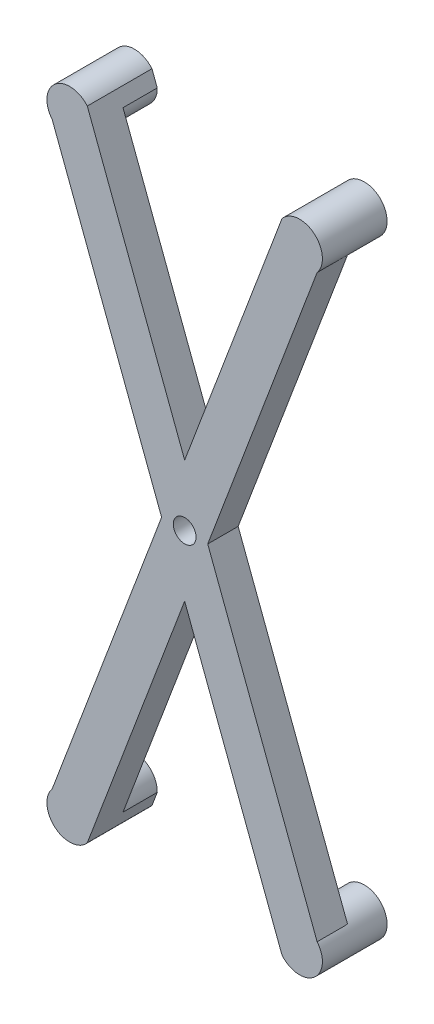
SolidWorks part; units mm, degrees
ref_plane "Plan de face" through (0, 0, 0) normal (0, 0, 1) x (1, 0, 0)
ref_plane "Plan de dessus" through (0, 0, 0) normal (0, 1, 0) x (1, 0, 0)
ref_plane "Plan de droite" through (0, 0, 0) normal (1, 0, 0) x (0, 0, -1)
sketch "Esquisse1" plane through (0, 0, 0) normal (0, 0, 1) x (1, 0, 0)
  line L15 (-60.1246, 38.5473) -> (-29.9246, -41.4527)
  line L16 (-55.5153, 42.3884) -> (-25.3153, -37.6116)
  line L17 (-29.9246, 42.3884) -> (-60.1246, -37.6116)
  line L18 (-25.3153, 38.5473) -> (-55.5153, -41.4527)
  circle A9 centre (-27.6199, -39.5321) radius 1.4
  circle A10 centre (-57.8199, -39.5321) radius 1.4
  circle A11 centre (-57.8199, 40.4679) radius 1.4
  circle A12 centre (-27.6199, 40.4679) radius 1.4
  circle A13 centre (-57.8199, -39.5321) radius 3
  circle A14 centre (-27.6199, -39.5321) radius 3
  circle A15 centre (-27.6199, 40.4679) radius 3
  circle A16 centre (-57.8199, 40.4679) radius 3
  circle A17 centre (-42.7199, 0.4679) radius 1.5
  point P0 (0, 0)
  point P18 (-29.9246, 42.3884)
  point P20 (-25.3153, 38.5473)
  point P21 (-25.3153, -37.6116)
  point P22 (-60.1246, -37.6116)
  point P23 (-55.5153, -41.4527)
  dimension "D9" = 2.8
extrude "Boss.-Extru.4" add sketch "Esquisse1" along normal blind 4 contours L16 A16 A11 | A16 L15 L17 L16 | A15 L17 L16 L18 | L17 A15 A12 | L18 L16 L17 L15 A17 | A14 L16 L18 L15 | A13 L18 L15 L17 | A13 L18 A10 | A14 L15 A9 | A9
sketch "Esquisse7" plane through (0, 0, 0) normal (0, 0, -1) x (-1, 0, 0)
  line L0 (55.5153, 42.3884) -> (60.1246, 38.5473)
  line L1 (29.9246, 42.3884) -> (25.3153, 38.5473)
  line L2 (60.1246, -37.6116) -> (55.5153, -41.4527)
  line L3 (29.9246, -41.4527) -> (25.3153, -37.6116)
  arc A0 (60.1246, 38.5473) -> (55.5153, 42.3884) centre (57.8199, 40.4679) ccw construction
  arc A1 (29.9246, 42.3884) -> (25.3153, 38.5473) centre (27.6199, 40.4679) ccw construction
  circle A2 centre (57.8199, -39.5321) radius 3
  circle A3 centre (27.6199, -39.5321) radius 3
  circle A4 centre (57.8199, 40.4679) radius 3
  circle A5 centre (27.6199, 40.4679) radius 3
  circle A6 centre (57.8199, 40.4679) radius 1.1
  circle A7 centre (27.6199, 40.4679) radius 1.1
  circle A8 centre (27.6199, -39.5321) radius 1.1
  circle A9 centre (57.8199, -39.5321) radius 1.1
extrude "Boss.-Extru.5" add sketch "Esquisse7" along normal blind 4.5 contours A6 L0 M12 | A6 L0 A4 M1 | A7 L1 M3 | A7 L1 A5 M2 | A9 L2 A2 M8 | A9 L2 M9 | A8 L3 A3 M7 | A8 L3 M6
